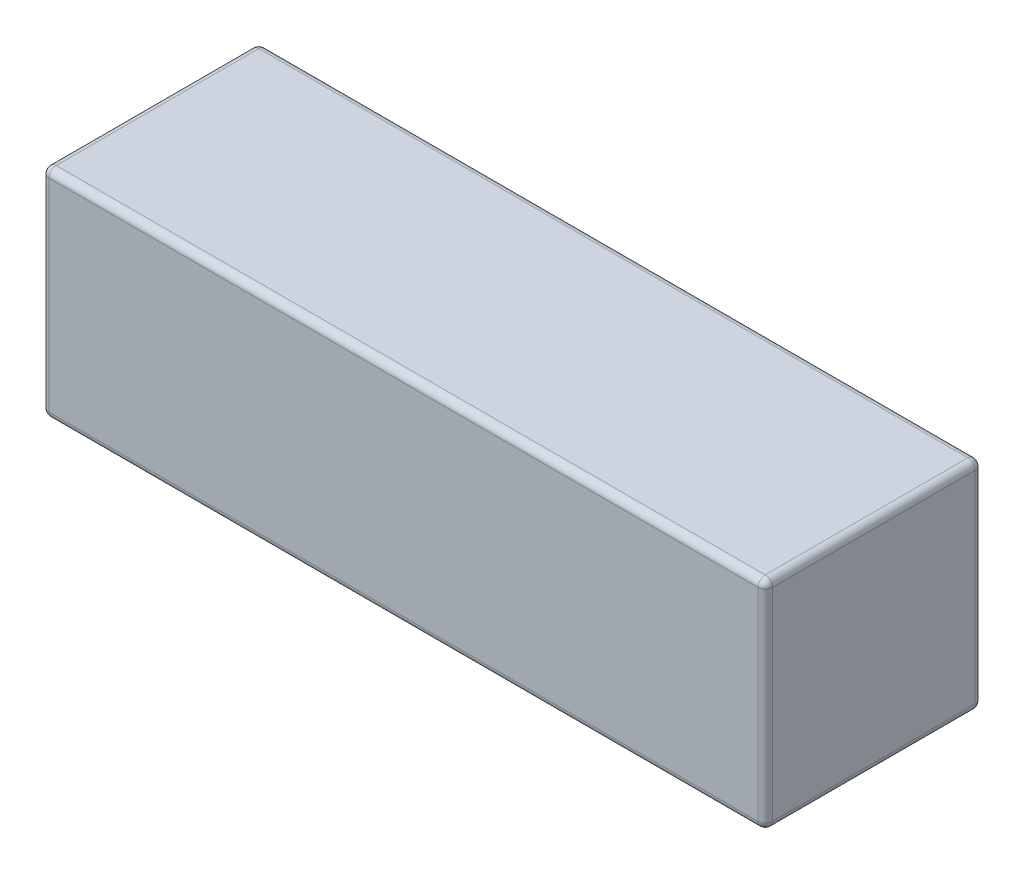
SolidWorks part; units mm, degrees
ref_plane "Front Plane" through (0, 0, 0) normal (0, 0, 1) x (1, 0, 0)
ref_plane "Top Plane" through (0, 0, 0) normal (0, 1, 0) x (1, 0, 0)
ref_plane "Right Plane" through (0, 0, 0) normal (1, 0, 0) x (0, 0, -1)
sketch "Sketch1" plane through (0, 0, 0) normal (1, 0, 0) x (0, 0, -1)
  line L1 (-15, -15) -> (15, -15)
  line L2 (-15, -15) -> (-15, 15)
  line L3 (-15, 15) -> (15, 15)
  line L4 (15, -15) -> (15, 15)
  line L5 (-15, -15) -> (15, 15) construction
  line L6 (-15, 15) -> (15, -15) construction
  point P0 (0, 0)
  dimension "D1" = 30
extrude "Boss-Extrude1" add sketch "Sketch1" along normal mid plane 100
fillet "Fillet1" radius 1 12 edges at (-50, -15, 0) (0, -15, -15) (-50, 0, -15) (50, -15, 0) (50, 0, -15) (0, 15, -15) (50, 15, 0) (-50, 15, 0) (0, 15, 15) (50, 0, 15) (0, -15, 15) (-50, 0, 15)
